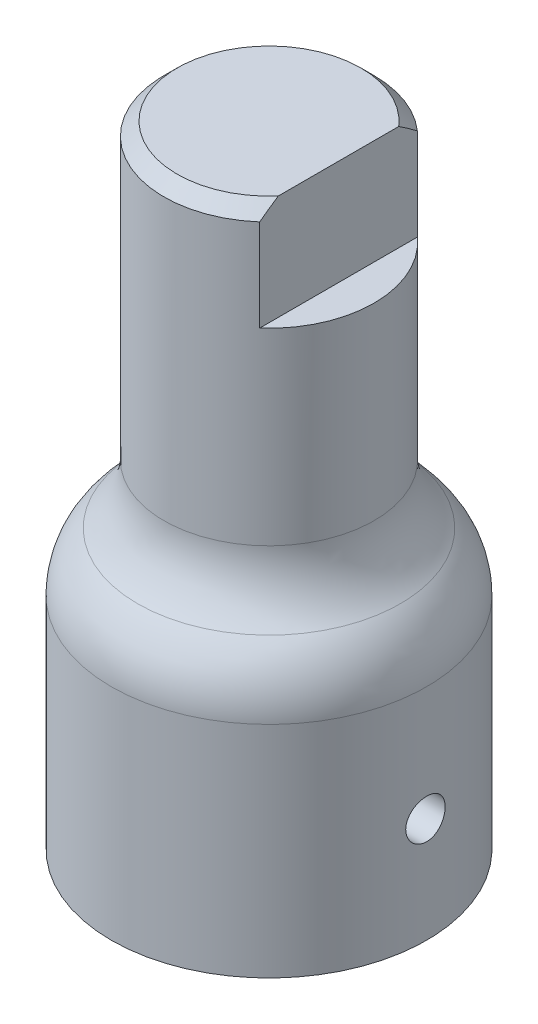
SolidWorks part; units mm, degrees
ref_plane "Front" through (0, 0, 0) normal (0, 0, 1) x (1, 0, 0)
ref_plane "Top" through (0, 0, 0) normal (0, 1, 0) x (1, 0, 0)
ref_plane "Right" through (0, 0, 0) normal (1, 0, 0) x (0, 0, -1)
sketch "Sketch1" plane through (0, 0, 0) normal (0, 1, 0) x (1, 0, 0)
  circle A0 centre (0, 0) radius 9.525
  dimension "D1" = 19.05
extrude "male end" add sketch "Sketch1" along normal blind 15.875
sketch "Sketch2" plane through (0, 0, 0) normal (0, 1, 0) x (-1, 0, 0)
  circle A0 centre (0, 0) radius 6.35
  dimension "D1" = 12.7
extrude "female end" add sketch "Sketch2" along normal blind 38.1
fillet "upper" radius 4.7625 1 edges at (0, 15.875, 6.35)
fillet "lower" radius 4.7625 1 edges at (0, 15.875, 9.525)
sketch "Sketch3" plane through (0, 0, 0) normal (0, -1, 0) x (1, 0, 0)
  line L0 (4.957, -3.9688) -> (4.957, 3.9688)
  arc A0 (4.957, 3.9688) -> (4.957, -3.9688) centre (0, 0) ccw
  circle A1 centre (0, 0) radius 9.525 construction
  dimension "D_diam" = 12.7
  dimension "D1" = 7.9375
extrude "D cut" cut sketch "Sketch3" against normal blind 12.7
sketch "Sketch5" plane through (4.957, 0, 0) normal (-1, 0, 0) x (0, 0, 1)
  line L0 (0, 0) -> (0, 6.35) construction
  circle A0 centre (0, 6.35) radius 1.1906
  dimension "D1" = 2.3813
  dimension "D2" = 6.35
extrude "set hole" cut sketch "Sketch5" against normal up to next
sketch "Sketch4" plane through (0, 38.1, 0) normal (0, 1, 0) x (-1, 0, 0)
  line L0 (-4.2001, 4.7625) -> (-4.2001, -4.7625)
  circle A0 centre (0, 0) radius 6.35 construction
  arc A1 (-4.2001, 4.7625) -> (-4.2001, -4.7625) centre (0, 0) ccw
  dimension "D1" = 9.525
extrude "D boss" cut sketch "Sketch4" against normal blind 6.35
chamfer "edge chamfer" distance 0.7937 angle 45 1 edges at (-6.35, 38.1, 0)
